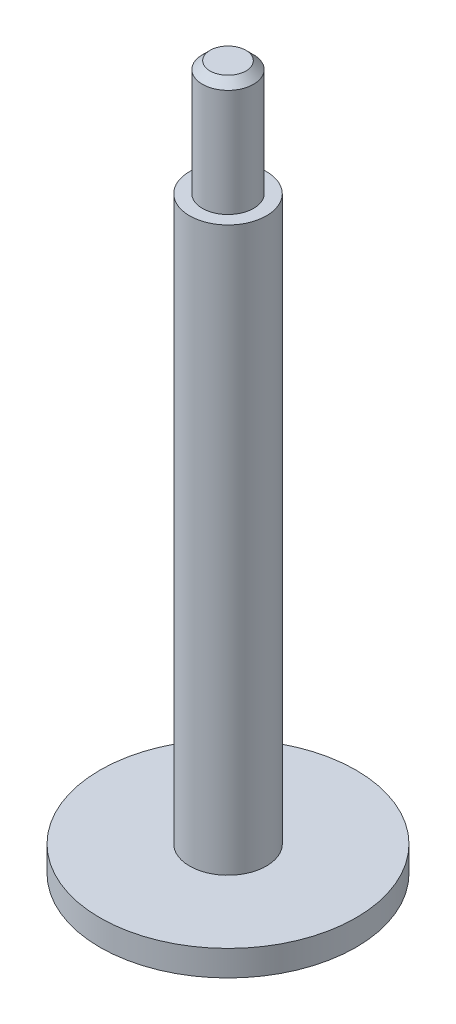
SolidWorks part; units mm, degrees
ref_plane "Face" through (0, 0, 0) normal (0, 0, 1) x (1, 0, 0)
ref_plane "Dessus" through (0, 0, 0) normal (0, 1, 0) x (1, 0, 0)
ref_plane "Droite" through (0, 0, 0) normal (1, 0, 0) x (0, 0, -1)
sketch "Esquisse1" plane through (0, 0, 0) normal (0, 0, 1) x (1, 0, 0)
  line L0 (0, 27.5) -> (0, 0)
  line L1 (0, 0) -> (-5, 0)
  line L2 (-5, 0) -> (-5, 1)
  line L3 (-5, 1) -> (-1.5, 1)
  line L4 (-1.5, 1) -> (-1.5, 23)
  line L5 (-1.5, 23) -> (-1, 23)
  line L6 (-1, 23) -> (-1, 27.5)
  line L7 (-1, 27.5) -> (0, 27.5)
  line L8 (0, 0) -> (0, -5.4607) construction
  dimension "D1" = 5
  dimension "D2" = 1
  dimension "D3" = 22
  dimension "D4" = 4.5
  dimension "D5" = 1.5
  dimension "D6" = 1
revolve "Révolution1" add sketch "Esquisse1" angle 360 about L8
chamfer "Chanfrein1" distance 0.3 angle 45
